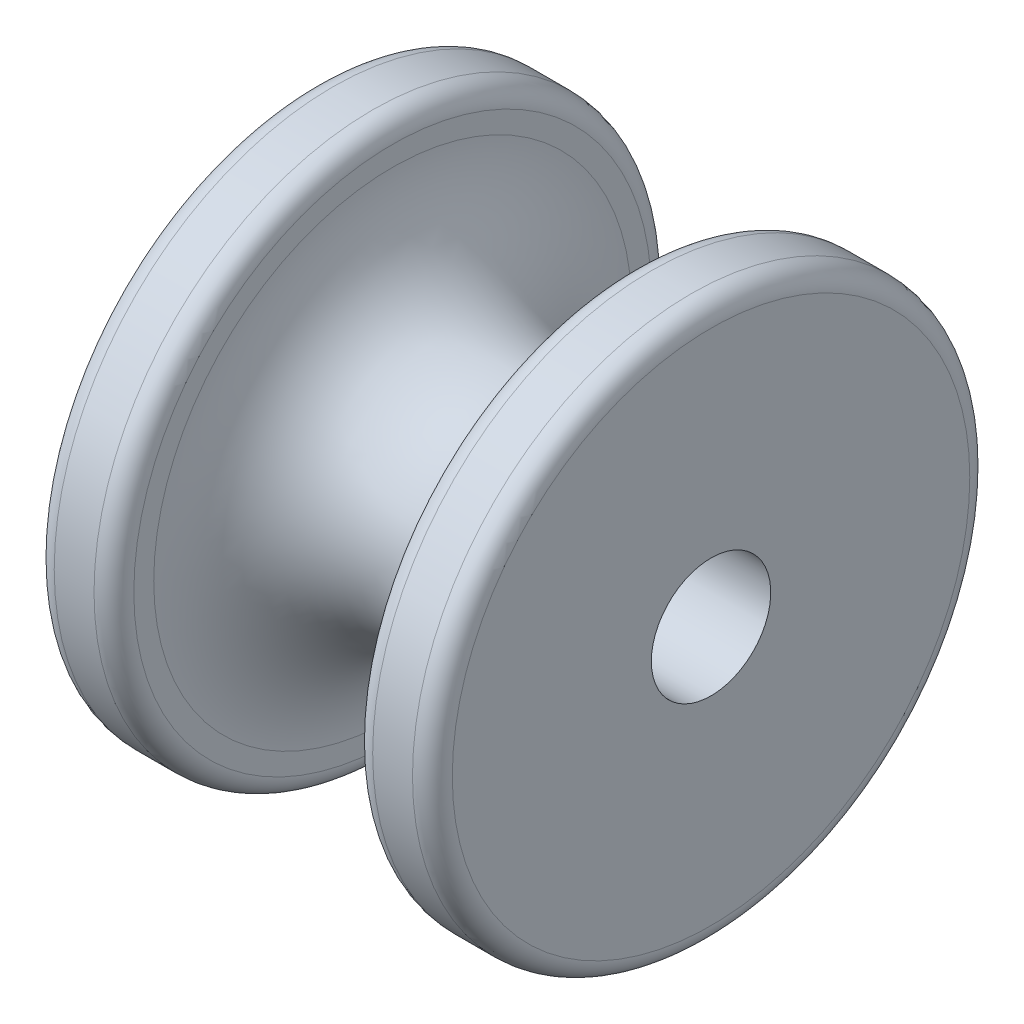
SolidWorks part; units mm, degrees
ref_plane "Plan de face" through (0, 0, 0) normal (0, 0, 1) x (1, 0, 0)
ref_plane "Plan de dessus" through (0, 0, 0) normal (0, 1, 0) x (1, 0, 0)
ref_plane "Plan de droite" through (0, 0, 0) normal (1, 0, 0) x (0, 0, -1)
sketch "Esquisse1" plane through (0, 0, 0) normal (0, 0, 1) x (1, 0, 0)
  line L0 (-15.1557, 0) -> (14.7812, 0) construction
  line L1 (0, 6) -> (0, -30) construction
  line L2 (-5, 0) -> (-5, 6.5)
  line L3 (-4.5, 7) -> (-3.5, 7)
  line L4 (-3, 6) -> (-3, 6.5)
  line L5 (3, 6) -> (3, 6.5)
  line L6 (4.5, 7) -> (3.5, 7)
  line L7 (5, 0) -> (5, 6.5)
  line L8 (-5, 0) -> (5, 0)
  arc A0 (-3, 6) -> (3, 6) centre (0, 6) ccw
  arc A1 (-5, 6.5) -> (-4.5, 7) centre (-4.5, 6.5) cw
  arc A2 (-3.5, 7) -> (-3, 6.5) centre (-3.5, 6.5) cw
  arc A3 (3.5, 7) -> (3, 6.5) centre (3.5, 6.5) ccw
  arc A4 (5, 6.5) -> (4.5, 7) centre (4.5, 6.5) ccw
  point P11 (-5, 7)
  point P22 (5, 7)
  point P23 (0, 3)
  dimension "D3" = 3
  dimension "D5" = 0.5
  dimension "D1" = 7
  dimension "D2" = 5
  dimension "D4" = 3
revolve "Révolution1" add sketch "Esquisse1" angle 360 about L0
sketch "Esquisse2" plane through (-5, 0, 0) normal (-1, 0, 0) x (0, 0, 1)
  circle A0 centre (0, 0) radius 1.5
  dimension "D1" = 3
extrude "Enlèv. mat.-Extru.1" cut sketch "Esquisse2" against normal blind 10
sketch "Esquisse3" plane through (0, 0, 0) normal (1, 0, 0) x (0, 0, -1)
  circle A0 centre (0, 0) radius 3
  dimension "D1" = 6
sketch "Esquisse4" plane through (-5, 0, 0) normal (-1, 0, 0) x (0, 0, 1)
  circle A0 centre (0, 5) radius 0.5
  point P2 (0, 0)
  point P4 (0, 0)
  dimension "D1" = 1
  dimension "D2" = 5
extrude "Boss.-Extru.1" add sketch "Esquisse4" along normal blind 0.5
